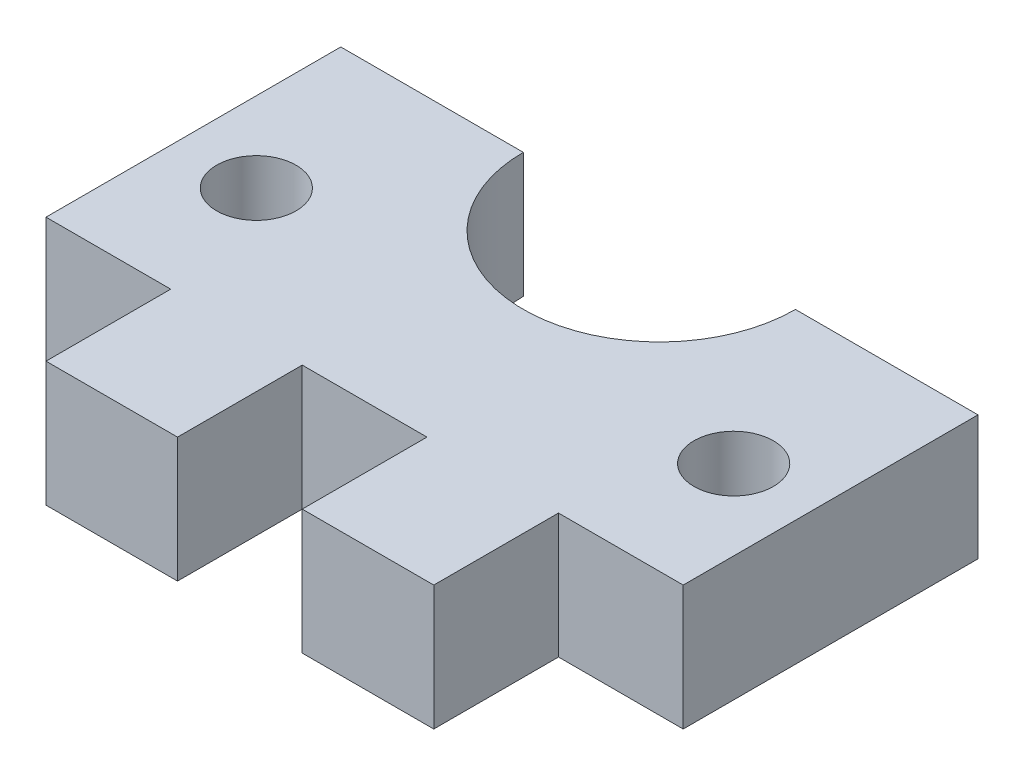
SolidWorks part; units mm, degrees
ref_plane "Front Plane" through (0, 0, 0) normal (0, 0, 1) x (1, 0, 0)
ref_plane "Top Plane" through (0, 0, 0) normal (0, 1, 0) x (1, 0, 0)
ref_plane "Right Plane" through (0, 0, 0) normal (1, 0, 0) x (0, 0, -1)
sketch "Sketch1" plane through (0, 0, 0) normal (0, 1, 0) x (1, 0, 0)
  line L0 (0, 0) -> (-17.1, 0) construction
  line L1 (-17.1, 0) -> (-17.1, 5.5) construction
  line L3 (0, 5.5) -> (0, 0) construction
  line L4 (-5.8, 5.5) -> (-11.3, 5.5) construction
  line L5 (-11.3, 5.5) -> (-11.3, 0) construction
  line L6 (-5.8, 5.5) -> (-5.8, 0) construction
  line L7 (-17.1, 5.5) -> (-22.6, 5.5) construction
  line L8 (-8.55, 5.5) -> (-8.55, 18.5) construction
  line L11 (-14.55, 18.5) -> (-22.6, 18.5)
  line L12 (5.5, 5.5) -> (0, 5.5) construction
  line L20 (-19.85, 5.5) -> (-17.1, 5.5)
  line L21 (-17.1, 5.5) -> (-17.1, 0)
  line L22 (-17.1, 0) -> (-11.3, 0)
  line L23 (-11.3, 0) -> (-11.3, 5.5)
  line L24 (-11.3, 5.5) -> (-5.8, 5.5)
  line L25 (-5.8, 5.5) -> (-5.8, 0)
  line L26 (-5.8, 0) -> (0, 0)
  line L27 (0, 0) -> (0, 5.5)
  line L28 (0, 5.5) -> (2.75, 5.5)
  line L33 (-22.6, 5.5) -> (-19.85, 5.5)
  line L36 (5.5, 5.5) -> (2.75, 5.5)
  line L37 (-19.075, 16.75) -> (-19.075, 11.25) construction
  line L38 (1.975, 16.75) -> (1.975, 11.25) construction
  line L41 (5.5, 5.5) -> (5.5, 29.5) construction
  line L42 (5.5, 29.5) -> (-22.6, 29.5) construction
  line L43 (-22.6, 29.5) -> (-22.6, 5.5) construction
  line L44 (-22.6, 18.5) -> (-22.6, 5.5)
  line L45 (-2.55, 18.5) -> (5.5, 18.5)
  line L46 (5.5, 18.5) -> (5.5, 5.5)
  circle A2 centre (-19.075, 11.25) radius 1.75
  circle A3 centre (1.975, 11.25) radius 1.75
  arc A5 (-14.55, 18.5) -> (-2.55, 18.5) centre (-8.55, 18.5) ccw
  point P8 (-8.55, 5.5)
  point P17 (-8.55, 5.5)
  dimension "D1" = 17.1
  dimension "D2" = 24
  dimension "D6" = 12
  dimension "D3" = 7.25
  dimension "D5" = 13
extrude "Boss-Extrude1" add sketch "Sketch1" along normal blind 5.5
